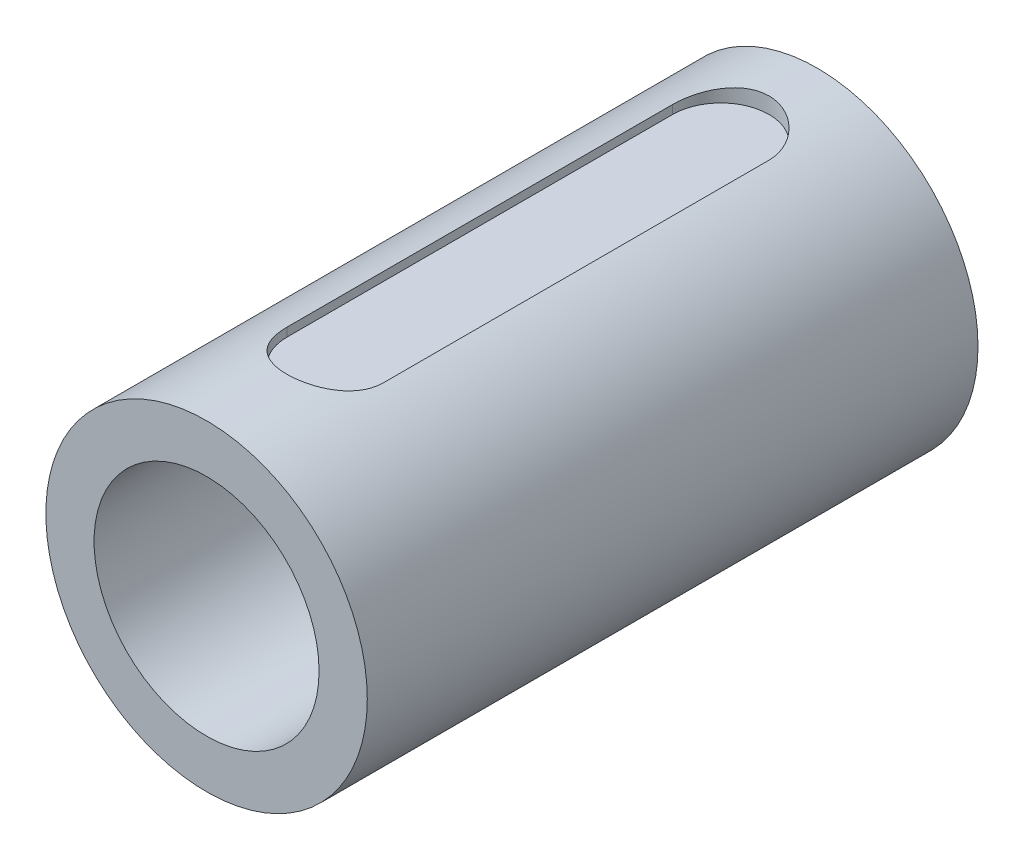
SolidWorks part; units mm, degrees
ref_plane "前视基准面" through (0, 0, 0) normal (0, 0, 1) x (1, 0, 0)
ref_plane "上视基准面" through (0, 0, 0) normal (0, 1, 0) x (1, 0, 0)
ref_plane "右视基准面" through (0, 0, 0) normal (1, 0, 0) x (0, 0, -1)
sketch "草图1" plane through (0, 0, 0) normal (0, 0, 1) x (1, 0, 0)
  circle A0 centre (0, 0) radius 3.5
  circle A1 centre (0, 0) radius 5
  dimension "D1" = 7
  dimension "D2" = 10
extrude "拉伸1" add sketch "草图1" against normal blind 19
ref_plane "基准面1" through (0, 4.5, 0) normal (0, 1, 0) x (-1, 0, 0)
sketch "草图2" plane through (0, 4.5, 0) normal (0, 1, 0) x (-1, 0, 0)
  line L0 (-1.5, -4) -> (-1.5, -16)
  line L1 (-1.5, -6) -> (-1.5, 0) construction
  line L2 (-1.5, -6) -> (-1.5, -19) construction
  line L3 (1.5, -6) -> (1.5, -19) construction
  line L4 (1.5, -16) -> (1.5, -4)
  line L5 (1.5, -6) -> (1.5, 0) construction
  line L6 (5, 0) -> (-5, 0) construction
  arc A0 (-1.5, -16) -> (1.5, -16) centre (0, -16) ccw
  arc A1 (1.5, -4) -> (-1.5, -4) centre (0, -4) ccw
  dimension "D1" = 12
  dimension "D2" = 4
extrude "切除-拉伸1" cut sketch "草图2" along normal up to next
